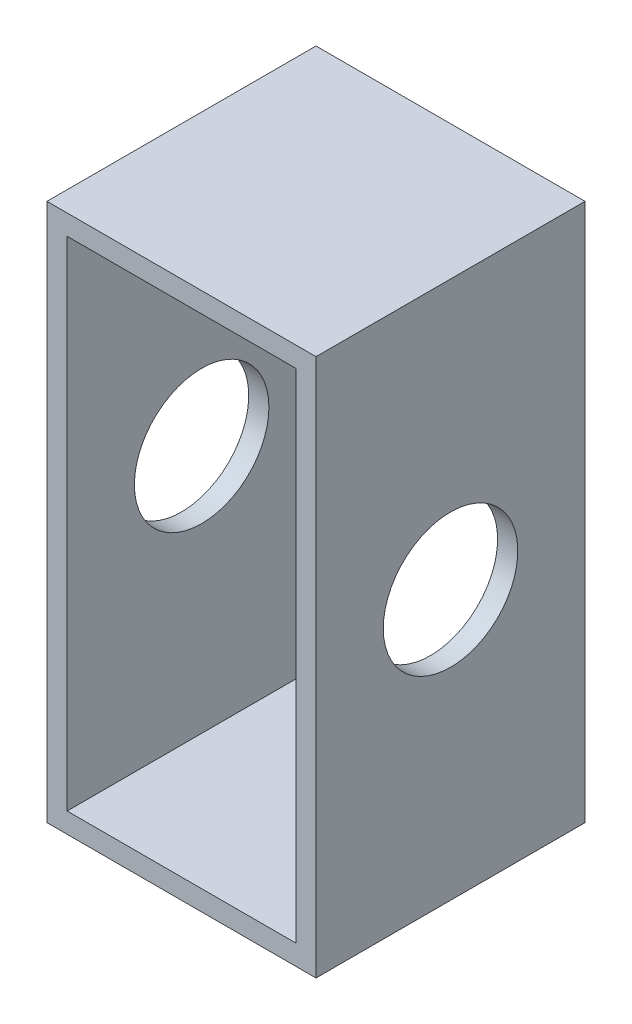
SolidWorks part; units mm, degrees
ref_plane "Front" through (0, 0, 0) normal (0, 0, 1) x (1, 0, 0)
ref_plane "Top" through (0, 0, 0) normal (0, 1, 0) x (1, 0, 0)
ref_plane "Right" through (0, 0, 0) normal (1, 0, 0) x (0, 0, -1)
sketch "Schizzo1" plane through (0, 0, 0) normal (0, 0, 1) x (1, 0, 0)
  line L1 (20, -40) -> (-20, -40)
  line L2 (20, -40) -> (20, 40)
  line L3 (20, 40) -> (-20, 40)
  line L4 (-20, -40) -> (-20, 40)
  line L5 (20, -40) -> (-20, 40) construction
  line L6 (20, 40) -> (-20, -40) construction
  line L7 (17, -37) -> (-17, -37)
  line L8 (17, -37) -> (17, 37)
  line L9 (17, 37) -> (-17, 37)
  line L10 (-17, -37) -> (-17, 37)
  line L11 (17, -37) -> (-17, 37) construction
  line L12 (17, 37) -> (-17, -37) construction
  point P0 (0, 0)
  point P6 (0, 0)
  dimension "D1" = 40
  dimension "D2" = 80
  dimension "D3" = 3
  dimension "D4" = 3
extrude "Estrusione-Estrusione1" add sketch "Schizzo1" along normal mid plane 40
sketch "Schizzo3" plane through (-20, 0, 0) normal (-1, 0, 0) x (0, 0, 1)
  circle A0 centre (0, 0) radius 10
  dimension "D1" = 20
extrude "Taglio-Estrusione1" cut sketch "Schizzo3" against normal up to surface (40 mm away)
